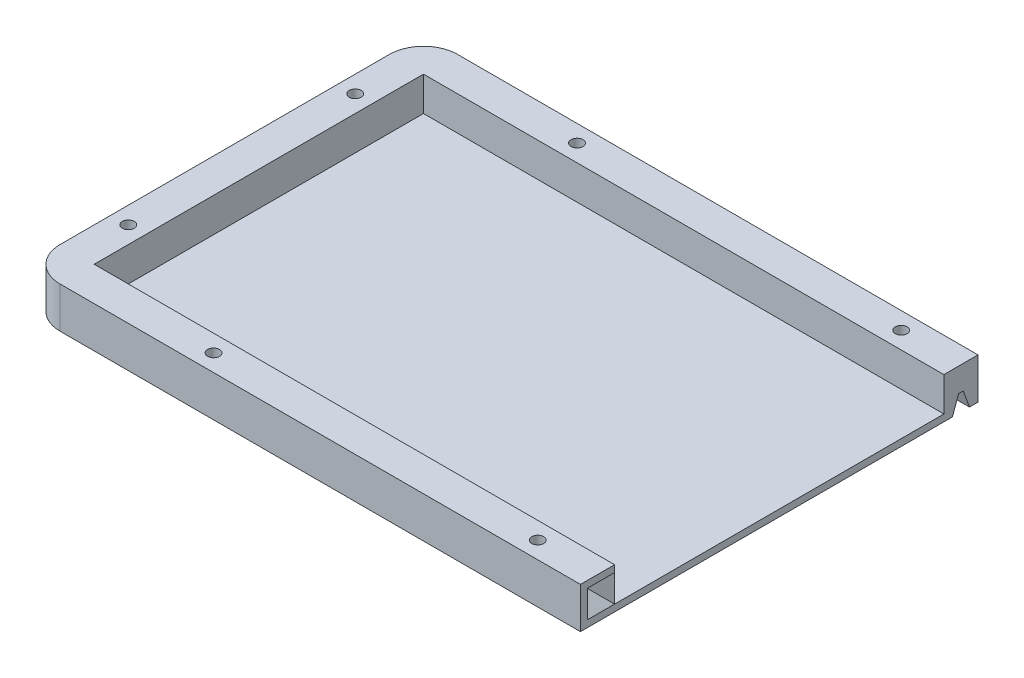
SolidWorks part; units mm, degrees
ref_plane "Front Plane" through (0, 0, 0) normal (0, 0, 1) x (1, 0, 0)
ref_plane "Top Plane" through (0, 0, 0) normal (0, 1, 0) x (1, 0, 0)
ref_plane "Right Plane" through (0, 0, 0) normal (1, 0, 0) x (0, 0, -1)
sketch "Sketch1" plane through (0, 0, 0) normal (0, 1, 0) x (1, 0, 0)
  line L1 (0, 0) -> (162.5, 0)
  line L2 (0, 0) -> (0, 116.5)
  line L3 (0, 116.5) -> (162.5, 116.5)
  line L4 (162.5, 0) -> (162.5, 116.5)
  dimension "D1" = 116.5
  dimension "D2" = 162.5
extrude "Boss-Extrude1" add sketch "Sketch1" along normal blind 2
sketch "Sketch2" plane through (0, 2, 0) normal (0, 1, 0) x (1, 0, 0)
  line L0 (19, 111.5) -> (39, 111.5)
  line L3 (162.5, 111.5) -> (39, 111.5)
  line L4 (5, 111.5) -> (5, 5)
  line L5 (5, 5) -> (162.5, 5)
  line L7 (0, 116.5) -> (0, 0) construction
  line L8 (162.5, 116.5) -> (0, 116.5) construction
  line L10 (162.5, 0) -> (162.5, 116.5) construction
  line L11 (0, 0) -> (162.5, 0) construction
  line L12 (0, 116.5) -> (39, 116.5) construction
  line L15 (19, 111.5) -> (5, 111.5)
  dimension "D1" = 5
  dimension "D2" = 5
  dimension "D3" = 5
  dimension "D4" = 39
extrude "Extrude-Thin1" add sketch "Sketch2" along normal blind 10 thin
fillet "Fillet1" radius 10 2 edges at (0, 6, -116.5) (0, 6, 0)
sketch "Sketch3" plane through (162.5, 0, 0) normal (1, 0, 0) x (0, 0, -1)
  line L0 (10, 12) -> (0, 12) construction
  line L5 (2, 10) -> (10, 10)
  line L6 (2, 10) -> (2, 2)
  line L7 (2, 2) -> (10, 2)
  line L8 (10, 10) -> (10, 2)
  line L9 (108.5, 10) -> (114.5, 10)
  line L10 (108.5, 10) -> (108.5, 2)
  line L11 (108.5, 2) -> (114.5, 2)
  line L12 (114.5, 10) -> (114.5, 2)
  line L13 (0, 12) -> (0, 0) construction
  line L14 (0, 0) -> (116.5, 0) construction
  line L15 (10, 12) -> (10, 2) construction
  line L16 (116.5, 12) -> (116.5, 0) construction
  line L17 (106.5, 12) -> (106.5, 2) construction
  dimension "D1" = 2
  dimension "D2" = 2
  dimension "D3" = 2
  dimension "D4" = 0
  dimension "D5" = 2
  dimension "D6" = 2
extrude "Cut-Extrude1" cut sketch "Sketch3" against normal blind 10 draft 45 contours L8 L5 L6 L7
sketch "Sketch4" plane through (0, 0, 0) normal (0, -1, 0) x (1, 0, 0)
  line L0 (0, -25) -> (5, -25) construction
  line L1 (0, -106.5) -> (0, -10) construction
  line L2 (5, 0) -> (5, -25) construction
  line L3 (10, 0) -> (162.5, 0) construction
  line L4 (50, 0) -> (50, -5) construction
  line L5 (0, -58.25) -> (58.1964, -58.25) construction
  circle A0 centre (5, -25) radius 3
  circle A1 centre (50, -5) radius 3
  circle A2 centre (145, -5) radius 3
  circle A3 centre (145, -111.5) radius 3
  circle A4 centre (50, -111.5) radius 3
  circle A5 centre (5, -91.5) radius 3
  dimension "D5" = 6
  dimension "D6" = 6
  dimension "D8" = 95
  dimension "D1" = 25
  dimension "D2" = 5
  dimension "D3" = 5
  dimension "D4" = 50
  dimension "D7" = 2
extrude "Cut-Extrude2" cut sketch "Sketch4" against normal blind 9
sketch "Sketch5" plane through (0, 9, 0) normal (0, -1, 0) x (1, 0, 0)
  circle A0 centre (145, -5) radius 3 construction
  circle A1 centre (145, -111.5) radius 3 construction
  circle A2 centre (50, -111.5) radius 3 construction
  circle A3 centre (5, -91.5) radius 3 construction
  circle A4 centre (5, -25) radius 3 construction
  circle A5 centre (50, -5) radius 3 construction
  circle A6 centre (5, -25) radius 1.75
  circle A7 centre (5, -91.5) radius 1.75
  circle A8 centre (50, -111.5) radius 1.75
  circle A9 centre (145, -111.5) radius 1.75
  circle A10 centre (145, -5) radius 1.75
  circle A11 centre (50, -5) radius 1.75
  dimension "D1" = 3.5
extrude "Cut-Extrude3" cut sketch "Sketch5" against normal through all
chamfer "Chamfer1" distance 0.75 6 edges at (5, 9, -28) (5, 9, -88.5) (50, 9, -108.5) (145, 9, -108.5) (145, 9, -8) (50, 9, -8)
sketch "Sketch6" plane through (0, 0, 0) normal (0, -1, 0) x (1, 0, 0)
  line L0 (10, 0) -> (162.5, 0) construction
  line L1 (162.5, 0) -> (162.5, -116.5) construction
  line L3 (87.5, -7.5) -> (137.5, -7.5)
  line L4 (87.5, -7.5) -> (87.5, -2.5)
  line L5 (87.5, -2.5) -> (137.5, -2.5)
  line L6 (137.5, -7.5) -> (137.5, -2.5)
  line L7 (87.5, -7.5) -> (137.5, -2.5) construction
  line L8 (87.5, -2.5) -> (137.5, -7.5) construction
  circle A0 centre (112.5, -5) radius 2.5 construction
  dimension "D3" = 5
  dimension "D1" = 5
  dimension "D2" = 50
  dimension "D4" = 50
extrude "Cut-Extrude4" cut sketch "Sketch6" against normal blind 5 draft 20
sketch "Sketch7" plane through (0, 0, 0) normal (0, -1, 0) x (1, 0, 0)
  line L0 (162.5, 0) -> (162.5, -116.5) construction
  line L1 (162.5, -109) -> (150, -109)
  line L2 (162.5, -109) -> (162.5, -114)
  line L3 (162.5, -114) -> (150, -114)
  line L4 (150, -109) -> (150, -114)
  line L5 (162.5, -116.5) -> (10, -116.5) construction
  point P6 (150, -111.5)
  dimension "D1" = 5
  dimension "D2" = 5
  dimension "D3" = 12.5
extrude "Cut-Extrude5" cut sketch "Sketch7" against normal blind 5
draft "Draft1" type of draft neutral plane draft angle 20 faces to draft 3 parameters "D1"=20
